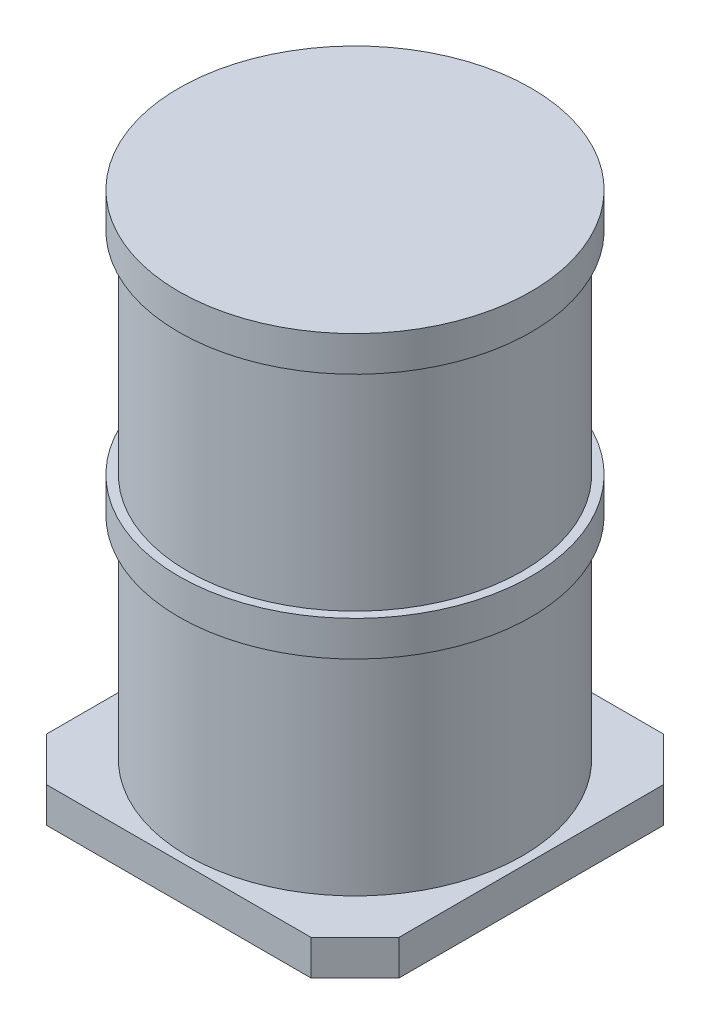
SolidWorks part; units mm, degrees
ref_plane "Front Plane" through (0, 0, 0) normal (0, 0, 1) x (1, 0, 0)
ref_plane "Top Plane" through (0, 0, 0) normal (0, 1, 0) x (1, 0, 0)
ref_plane "Right Plane" through (0, 0, 0) normal (1, 0, 0) x (0, 0, -1)
sketch "Sketch1" plane through (0, 0, 0) normal (0, 1, 0) x (1, 0, 0)
  circle A0 centre (0, 0) radius 2.413
extrude "Boss-Extrude1" add sketch "Sketch1" along normal blind 3.048
sketch "Sketch2" plane through (0, 3.048, 0) normal (0, 1, 0) x (1, 0, 0)
  circle A0 centre (0, 0) radius 2.54
extrude "Boss-Extrude2" add sketch "Sketch2" along normal blind 0.508
sketch "Sketch3" plane through (0, 3.556, 0) normal (0, 1, 0) x (1, 0, 0)
  circle A0 centre (0, 0) radius 1.016
extrude "Cut-Extrude1" cut sketch "Sketch3" against normal blind 1.27
sketch "Sketch4" plane through (0, 0, 0) normal (0, -1, 0) x (1, 0, 0)
  line L11 (-2.54, -2.54) -> (2.54, -2.54)
  line L12 (-2.54, -2.54) -> (-2.54, 2.54)
  line L13 (-2.54, 2.54) -> (2.54, 2.54)
  line L14 (2.54, -2.54) -> (2.54, 2.54)
  line L15 (-2.54, -2.54) -> (2.54, 2.54) construction
  line L16 (-2.54, 2.54) -> (2.54, -2.54) construction
  point P0 (0, 0)
  point P14 (0, 0)
extrude "Boss-Extrude3" add sketch "Sketch4" along normal blind 0.508
sketch "Sketch5" plane through (0, -0.508, 0) normal (0, -1, 0) x (1, 0, 0)
  circle A0 centre (0, 0) radius 1.016
extrude "Cut-Extrude2" cut sketch "Sketch5" against normal blind 1.27
chamfer "Chamfer1" distance 0.635 angle 45 4 edges at (2.54, -0.254, -2.54) (2.54, -0.254, 2.54) (-2.54, -0.254, -2.54) (-2.54, -0.254, 2.54)
sketch "Sketch8" plane through (0, 3.556, 0) normal (0, 1, 0) x (1, 0, 0)
  circle A0 centre (0, 0) radius 2.413
extrude "Boss-Extrude4" add sketch "Sketch8" along normal blind 3.048
sketch "Sketch9" plane through (0, 6.604, 0) normal (0, 1, 0) x (1, 0, 0)
  circle A0 centre (0, 0) radius 2.54
extrude "Boss-Extrude5" add sketch "Sketch9" along normal blind 0.508
